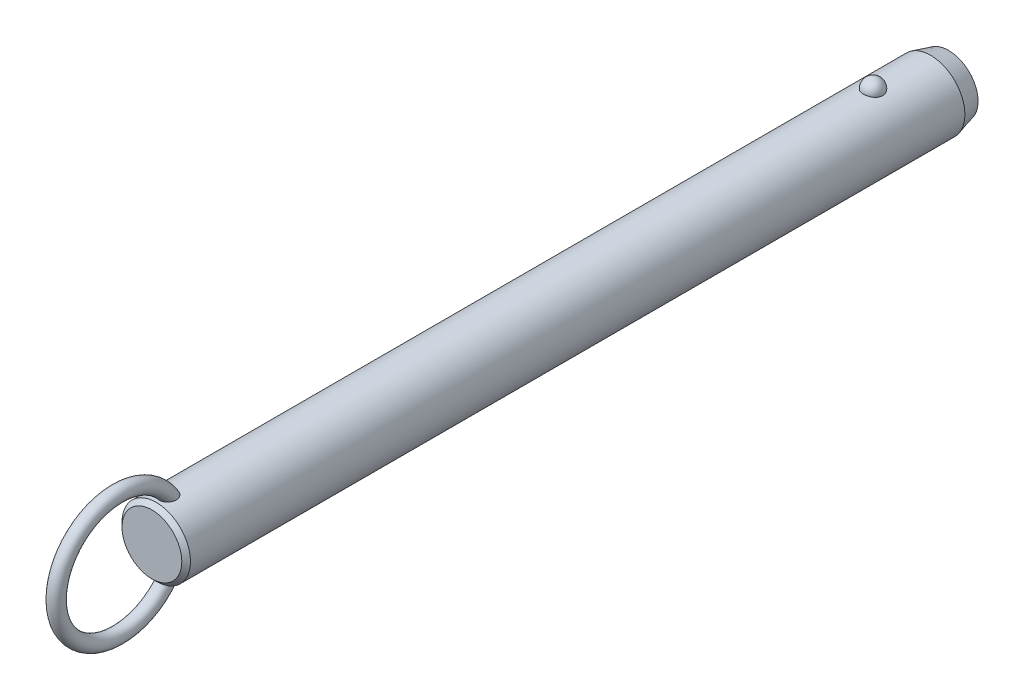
SolidWorks part; units mm, degrees
ref_plane "Front Plane" through (0, 0, 0) normal (0, 0, 1) x (1, 0, 0)
ref_plane "Top Plane" through (0, 0, 0) normal (0, 1, 0) x (1, 0, 0)
ref_plane "Right Plane" through (0, 0, 0) normal (1, 0, 0) x (0, 0, -1)
sketch "Sketch2" plane through (0, 0, 0) normal (0, 0, 1) x (1, 0, 0)
  circle A0 centre (0, 0) radius 9.5
  point P3 (0, 9.5)
  dimension "D1" = 19
extrude "Boss-Extrude1" add sketch "Sketch2" along normal blind 188
sketch "Sketch3" plane through (0, 0, 0) normal (0, 0, -1) x (-1, 0, 0)
  circle A0 centre (0, 0) radius 9.5
  dimension "D1" = 19
extrude "Boss-Extrude2" add sketch "Sketch3" along normal blind 23.7
chamfer "Chamfer1" distance 5 angle 15 1 edges at (-9.5, 0, -23.7)
sketch "Sketch12" plane through (0, 0, 0) normal (1, 0, 0) x (0, 0, -1)
  line L0 (-188, 9.5) -> (-188, -9.5) construction
  point P0 (-188, 0)
sketch "Sketch13" plane through (0, 0, 0) normal (1, 0, 0) x (0, 0, -1)
  circle A0 centre (-207.05, 0) radius 19.05
  point P2 (-188, 0)
  dimension "D1" = 38.1
sketch "Sketch14" plane through (0, 0, 0) normal (0, 1, 0) x (1, 0, 0)
  circle A0 centre (0, -190) radius 2
  point P2 (0, -188)
  dimension "D1" = 4
sweep "Sweep1" add profiles "Sketch14" path "Sketch13"
sketch "Sketch15" plane through (0, 0, 188) normal (0, 0, 1) x (1, 0, 0)
  circle A0 centre (0, 0) radius 9.5
  dimension "D1" = 19
extrude "Boss-Extrude3" add sketch "Sketch15" along normal blind 9.52
chamfer "Chamfer2" distance 1.2 angle 45 1 edges at (9.5, 0, 197.52)
sketch "Sketch18" plane through (0, 0, 0) normal (1, 0, 0) x (0, 0, -1)
  line L0 (18.7, 9.5) -> (-190.5378, 9.5) construction
  line L1 (2.7, 12.2) -> (2.7, 6.8)
  line L2 (-190.5378, -9.5) -> (18.7, -9.5) construction
  arc A0 (2.7, 12.2) -> (2.7, 6.8) centre (2.7, 9.5) ccw
  point P4 (0, 9.5)
  dimension "D1" = 21.7
revolve "Revolve1" add sketch "Sketch18" angle 360 about L1
